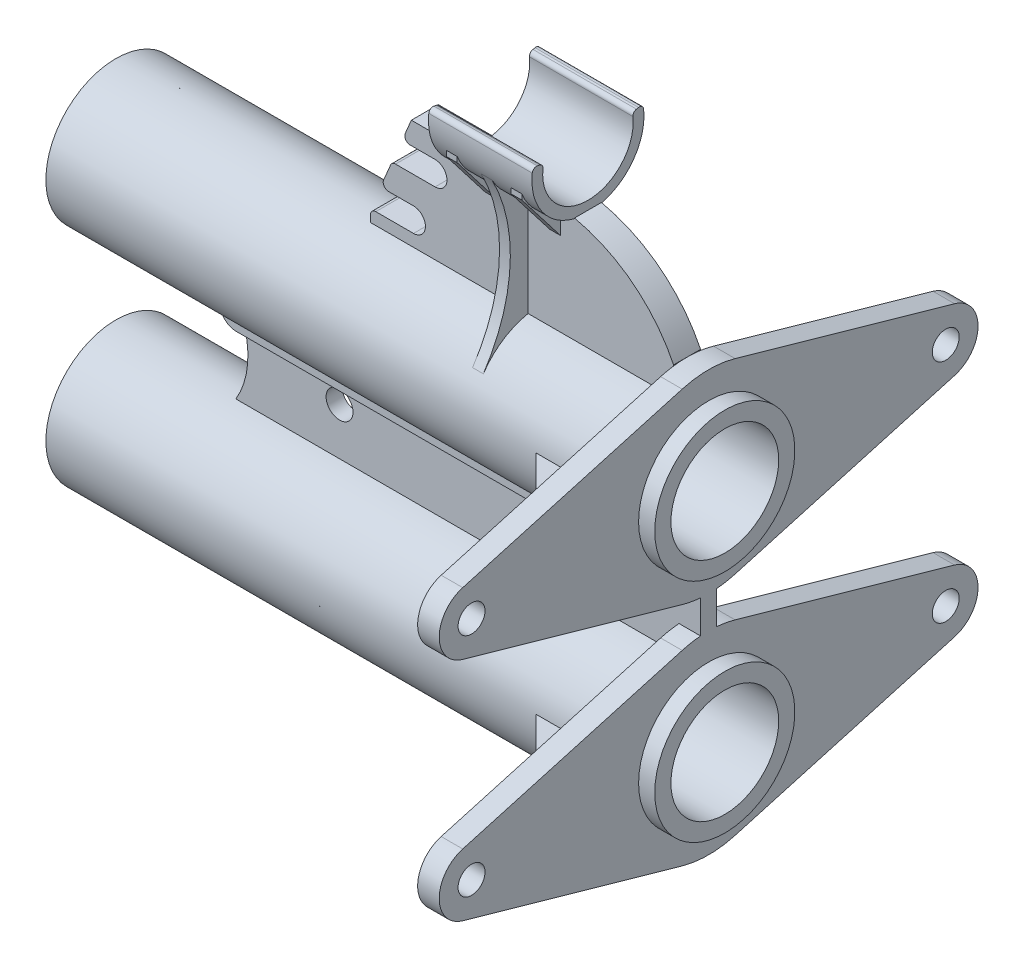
SolidWorks part; units mm, degrees
ref_plane "Front" through (0, 0, 0) normal (0, 0, 1) x (1, 0, 0)
ref_plane "Top" through (0, 0, 0) normal (0, 1, 0) x (1, 0, 0)
ref_plane "Right" through (0, 0, 0) normal (1, 0, 0) x (0, 0, -1)
sketch "Sketch1"
  dimension "D1" = 16.51
extrude "tube" add sketch "Sketch1" against normal blind 69.85
sketch "Sketch2"
  dimension "D2" = 7.62
  dimension "D4" = 3.175
  dimension "D3" = 63.5
  dimension "D1" = 3.175
extrude "flange" add sketch "Sketch2" against normal blind 2.54
sketch "Sketch3"
  dimension "D1" = 1.905
extrude "hole" cut sketch "Sketch3" against normal through all
sketch "Sketch4"
  dimension "D1" = 1.905
extrude "circular boss" add sketch "Sketch4" along normal blind 1.905
sketch "Sketch6"
  dimension "D1" = 0.9525
  dimension "D2" = 9.525
  dimension "D3" = 9.525
extrude "brace" add sketch "Sketch6" along normal mid plane 1.905
mirror "Mirror1" about plane through (0, 0, 0) normal (0, 0, 1) of "brace"
sketch "Sketch5"
  dimension "D6" = 3.175
  dimension "D1" = 0.9525
  dimension "D2" = 53.34
  dimension "D3" = 55.372
  dimension "D4" = 0.9525
  dimension "D5" = 10.16
  dimension "D7" = 12.7
  dimension "D8" = 29.845
  dimension "D9" = 5.4864
extrude "center plate" add sketch "Sketch5" along normal mid plane 1.905
pattern_linear "upper tube&flange" count 2 spacing 26.67 along (0, 1, 0) of "Mirror1", "brace", "tube", "flange", "hole", "circular boss"
sketch "Sketch7"
  dimension "D3" = 5.08
  dimension "D1" = 12.7
  dimension "D2" = 15.24
  dimension "D5" = 7.62
  dimension "D6" = 1.27
  dimension "D7" = 30.9055
  dimension "D8" = 35.7315
  dimension "D9" = 2.6063
  dimension "D4" = 0.9525
extrude "sight" add sketch "Sketch7" along normal mid plane 3.175
fillet "R025" radius 0.635 4 edges at (-34.546, 45.0187, 0) (-35.7315, 42.2108, 0) (-37.086, 39.0029, 0) (-38.2715, 36.195, 0)
ref_plane "centersupport" through (-20.32, 0, 0) normal (1, 0, 0) x (0, 0, -1)
sketch "Sketch8"
  dimension "D1" = 13.208
  dimension "D2" = 1.27
  dimension "D3" = 0.635
extrude "ammo holder" add sketch "Sketch8" along normal mid plane 12.192 thin
fillet "R020" radius 0.508 4 edges at (-20.32, 54.6198, 5.2344) (-20.32, 54.864, 6.4807) (-20.32, 54.864, -6.4807) (-20.32, 54.6198, -5.2344)
sketch "Sketch9"
  dimension "D1" = 3.683
extrude "support" add sketch "Sketch9" against normal mid plane 1.27
ref_plane "brace plane" through (-23.495, 0, 0) normal (-1, 0, 0) x (0, 0, 1)
sketch "Sketch10"
  dimension "D1" = 2.54
  dimension "D3" = 0.635
  dimension "D2" = 0.127
extrude "support brace" add sketch "Sketch10" along normal blind 1.27
mirror "Mirror2" about plane through (-20.32, 0, 0) normal (1, 0, 0) of "support brace"
sketch "Sketch11"
  dimension "D1" = 1.905
  dimension "D2" = 1.905
extrude "rail" add sketch "Sketch11" along normal up to surface (51.5061 mm away)
fillet "R075" radius 1.905 1 edges at (-28.293, 17.0203, -2.8575)
mirror "Mirror3" about plane through (0, 0, 0) normal (0, 0, 1) of "R075", "rail", "support", "support brace", "Mirror2"
